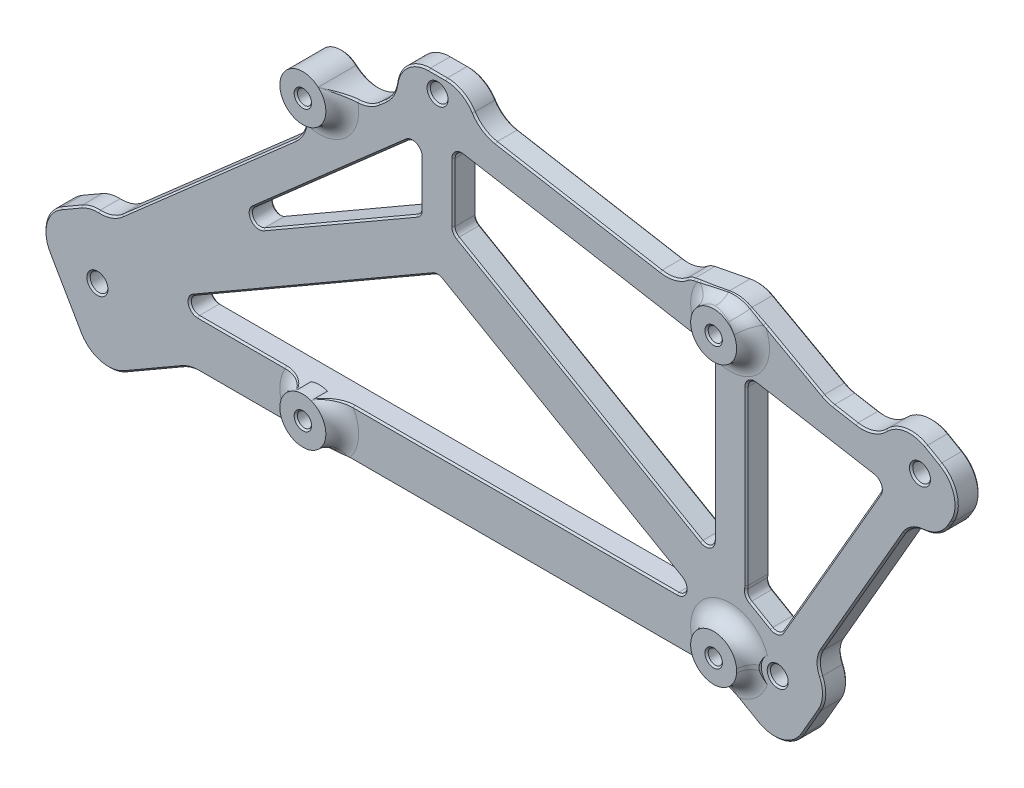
SolidWorks part; units mm, degrees
ref_plane "Płaszczyzna przednia" through (0, 0, 0) normal (0, 0, 1) x (1, 0, 0)
ref_plane "Płaszczyzna górna" through (0, 0, 0) normal (0, 1, 0) x (1, 0, 0)
ref_plane "Płaszczyzna prawa" through (0, 0, 0) normal (1, 0, 0) x (0, 0, -1)
sketch "Szkic1" plane through (0, 0, 0) normal (0, 0, 1) x (1, 0, 0)
  line L0 (-170.2972, -52.083) -> (-130.9522, -29.3671)
  line L1 (-130.4522, -29.2331) -> (-63.6654, -29.2331)
  line L2 (-63.1654, -29.3671) -> (-23.8203, -52.083)
  line L3 (92.7156, 157.7631) -> (-49.7844, -89.0541)
  line L4 (-286.8331, 157.7631) -> (-144.3331, -89.0541)
  line L5 (-239.5588, 239.6447) -> (45.4412, 239.6447)
  line L6 (0.4412, 198.213) -> (0.4412, 243.6447)
  line L7 (33.9686, 139.8739) -> (0.5752, 197.713)
  line L8 (73.6797, 116.792) -> (34.3346, 139.5079)
  line L9 (-228.454, 139.5089) -> (-267.7991, 116.7931)
  line L10 (-213.1413, 166.0521) -> (-205.4413, 179.3889)
  line L11 (-194.5588, 243.6447) -> (-194.5588, 198.213)
  line L12 (-112.0588, 114.6447) -> (-112.0588, 209.6447)
  line L13 (-82.0588, 114.6447) -> (-82.0588, 209.6447)
  line L14 (-79.2876, 109.8449) -> (2.9848, 62.3449)
  line L15 (-94.2876, 83.8641) -> (-12.0152, 36.3641)
  line L16 (-182.1024, 36.3641) -> (-99.8299, 83.8641)
  line L17 (-114.8299, 109.8449) -> (-197.1024, 62.3449)
  line L18 (-127.7266, 15.9423) -> (-127.7266, -9.6077)
  line L19 (-127.7266, -9.6077) -> (-161.4266, -9.6077)
  line L20 (-161.4266, -9.6077) -> (-161.4266, 15.9423)
  line L21 (-161.4266, 15.9423) -> (-127.7266, 15.9423)
  line L22 (-88.1564, 15.9423) -> (-88.1564, -9.6077)
  line L23 (-88.1564, -9.6077) -> (-121.8564, -9.6077)
  line L24 (-121.8564, -9.6077) -> (-121.8564, 15.9423)
  line L25 (-121.8564, 15.9423) -> (-88.1564, 15.9423)
  line L26 (-21.873, -10.118) -> (-80.873, -10.118)
  line L27 (-83.873, -7.118) -> (-83.873, 16.882)
  line L28 (-80.873, 19.882) -> (-21.873, 19.882)
  line L29 (-18.873, 16.882) -> (-18.873, -7.118)
  line L30 (-78.2007, 139.4434) -> (-78.2007, 185.4434)
  line L31 (-78.2007, 185.4434) -> (5.7993, 185.4434)
  line L32 (5.7993, 185.4434) -> (5.7993, 139.4434)
  line L33 (5.7993, 139.4434) -> (-78.2007, 139.4434)
  line L34 (-83.1934, 227.2419) -> (-83.1934, 156.9419)
  line L35 (-83.1934, 156.9419) -> (-183.8934, 156.9419)
  line L36 (-183.8934, 156.9419) -> (-183.8934, 227.2419)
  line L37 (-183.8934, 227.2419) -> (-83.1934, 227.2419)
  line L38 (-194.5588, 23.3553) -> (-194.5588, 133.3553)
  line L39 (-194.5588, 133.3553) -> (0.4412, 133.3553)
  line L40 (0.4412, 133.3553) -> (0.4412, 23.3553)
  line L41 (0.4412, 23.3553) -> (-194.5588, 23.3553)
  line L42 (-239.5588, 209.6447) -> (45.4412, 209.6447)
  line L43 (-260.8524, 172.7631) -> (-118.3524, -74.0541)
  line L44 (66.7348, 172.7631) -> (-75.7652, -74.0541)
  line L45 (-86.6216, 146.6919) -> (-107.8381, 146.6919)
  line L46 (23.9013, 133.3553) -> (4.8104, 133.3553)
  line L47 (23.9013, 93.3553) -> (23.9013, 133.3553)
  line L48 (4.8104, 93.3553) -> (23.9013, 93.3553)
  line L49 (4.8104, 133.3553) -> (4.8104, 93.3553)
  circle A0 centre (-133.0588, 38.3553) radius 1.65
  circle A1 centre (-133.0588, 123.3553) radius 1.65
  circle A2 centre (-8.0588, 38.3553) radius 1.65
  circle A3 centre (-8.0588, 123.3553) radius 1.65
  circle A4 centre (-2.5588, 128.3553) radius 2
  circle A5 centre (-189.5588, 28.3553) radius 2
  circle A6 centre (-130.0766, 3.1673) radius 1.65
  circle A7 centre (-159.0766, 3.1673) radius 1.65
  circle A8 centre (-119.5064, 3.1673) radius 1.65
  circle A9 centre (-90.5064, 3.1673) radius 1.65
  circle A10 centre (-80.373, 16.382) radius 1.25
  circle A11 centre (-80.373, -6.618) radius 1.25
  circle A12 centre (-22.373, 16.382) radius 1.25
  circle A13 centre (-22.373, -6.618) radius 1.25
  circle A14 centre (-74.2007, 143.4434) radius 1.6
  circle A15 centre (1.7993, 143.4434) radius 1.6
  circle A16 centre (1.7993, 181.4434) radius 1.6
  circle A17 centre (-74.2007, 181.4434) radius 1.6
  circle A18 centre (-85.9434, 159.6919) radius 1.75
  circle A19 centre (-149.4434, 186.3919) radius 1.75
  circle A20 centre (-101.4434, 223.9919) radius 1.75
  circle A21 centre (-163.3434, 223.9919) radius 1.75
  circle A22 centre (-181.1434, 188.9919) radius 1.75
  arc A23 (-83.873, -7.118) -> (-80.873, -10.118) centre (-80.873, -7.118) ccw
  arc A24 (-80.873, 19.882) -> (-83.873, 16.882) centre (-80.873, 16.882) ccw
  arc A25 (-18.873, 16.882) -> (-21.873, 19.882) centre (-21.873, 16.882) ccw
  arc A26 (-21.873, -10.118) -> (-18.873, -7.118) centre (-21.873, -7.118) ccw
  circle A27 centre (10.3104, 130.8553) radius 1.5
  circle A28 centre (21.4013, 98.8553) radius 1.5
  circle A29 centre (-97.0588, 151.4419) radius 2.7
  dimension "D1" = 30
sketch "Szkic2" plane through (0, 0, 0) normal (0, 0, 1) x (1, 0, 0)
  line L0 (6.4412, 38.3316) -> (49.7252, 113.3016) construction
  line L1 (92.7156, 157.7631) -> (-49.7844, -89.0541) construction
  line L2 (-286.8331, 157.7631) -> (-144.3331, -89.0541) construction
  line L3 (-112.0588, 114.6447) -> (-112.0588, 209.6447) construction
  line L4 (-194.5588, 23.3553) -> (-194.5588, 133.3553) construction
  line L5 (-97.2298, 146.6919) -> (-97.2298, 133.3553) construction
  line L6 (-86.6216, 146.6919) -> (-107.8381, 146.6919) construction
  line L7 (-194.5588, 133.3553) -> (0.4412, 133.3553) construction
  line L8 (0.4412, 133.3553) -> (0.4412, 23.3553) construction
  line L9 (73.6797, 116.792) -> (34.3346, 139.5079) construction
  line L10 (-109.7298, 145.1919) -> (-84.7298, 145.1919)
  line L11 (-84.7298, 145.1919) -> (-84.7298, 133.1919)
  line L12 (-109.7298, 145.1919) -> (-109.7298, 133.1919)
  line L13 (-200.8841, 13.895) -> (-220.3841, 47.67)
  line L14 (64.5505, 113.9798) -> (9.053, 17.8553)
  line L15 (9.053, 17.8553) -> (-12.5976, 30.3553)
  line L16 (-200.8841, 13.895) -> (-172.374, 30.3553)
  line L17 (-220.3841, 47.67) -> (-198.7334, 60.17)
  line L18 (-198.7334, 60.17) -> (-194.2674, 52.4346)
  line L19 (-194.2674, 52.4346) -> (-102.2298, 105.5726)
  line L20 (-102.2298, 105.5726) -> (-102.2298, 133.1919)
  line L21 (-102.2298, 133.1919) -> (-109.7298, 133.1919)
  line L22 (-84.7298, 133.1919) -> (-92.2298, 133.1919)
  line L23 (-92.2298, 133.1919) -> (-92.2298, 105.7701)
  line L24 (64.5505, 113.9798) -> (42.8999, 126.4798)
  line L26 (-114.8299, 109.8449) -> (-197.1024, 62.3449) construction
  line L27 (-172.374, 30.3553) -> (-12.5976, 30.3553)
  line L28 (42.8999, 126.4798) -> (35.3999, 113.4894)
  line L29 (35.3999, 113.4894) -> (41.8951, 109.7394)
  line L30 (41.8951, 109.7394) -> (9.6111, 53.822)
  line L31 (9.6111, 53.822) -> (3.1159, 57.572)
  line L32 (3.1159, 57.572) -> (0.1499, 52.4346)
  line L33 (0.1499, 52.4346) -> (-92.2298, 105.7701)
  line L34 (-79.2876, 109.8449) -> (2.9848, 62.3449) construction
  line L36 (66.7348, 172.7631) -> (-75.7652, -74.0541) construction
  circle A0 centre (-97.0588, 140.0236) radius 2.7
  circle A1 centre (6.4412, 38.3316) radius 2.7
  circle A2 centre (-200.5588, 38.3316) radius 2.7
  circle A3 centre (49.7252, 113.3016) radius 2.7
  circle A4 centre (-200.5588, 38.3316) radius 6 construction
  circle A5 centre (-97.0588, 140.0236) radius 6 construction
  circle A6 centre (49.7252, 113.3016) radius 6 construction
  circle A7 centre (6.4412, 38.3316) radius 6 construction
  point P27 (-97.2298, 140.0236)
  dimension "D4" = 5.4
  dimension "D5" = 12
  dimension "D1" = 15
  dimension "D2" = 15
  dimension "D3" = 15
  dimension "D6" = 15
  dimension "D7" = 12.5
  dimension "D8" = 12.5
  dimension "D9" = 1.5
  dimension "D10" = 12.5
  dimension "D11" = 12.5
  dimension "D12" = 10
  dimension "D13" = 12
  dimension "D14" = 10
  dimension "D15" = 25
  dimension "D16" = 18
  dimension "D17" = 21
  dimension "D18" = 8
  dimension "D19" = 25
  dimension "D20" = 8
  dimension "D21" = 10
  dimension "D22" = 25
  dimension "D23" = 10
  dimension "D24" = 25
  dimension "D25" = 15
  dimension "D26" = 15
extrude "Dodanie-wyciągnięcie1" add sketch "Szkic2" along normal blind 7
sketch "Szkic3" plane through (0, 0, 7) normal (0, 0, 1) x (1, 0, 0)
  line L0 (-92.2298, 133.1919) -> (41.8951, 109.7394) construction
  line L1 (-91.3686, 138.1172) -> (42.7563, 114.6647)
  line L2 (-93.091, 128.2666) -> (41.0339, 104.8142)
  line L3 (-102.2298, 133.1919) -> (-194.2674, 52.4346) construction
  line L4 (-98.9321, 129.4336) -> (-190.9697, 48.6763)
  line L5 (-105.5275, 136.9503) -> (-197.5651, 56.193)
  arc A0 (-91.3686, 138.1172) -> (-93.091, 128.2666) centre (-92.2298, 133.1919) ccw
  arc A1 (41.0339, 104.8142) -> (42.7563, 114.6647) centre (41.8951, 109.7394) ccw
  arc A2 (-98.9321, 129.4336) -> (-105.5275, 136.9503) centre (-102.2298, 133.1919) ccw
  arc A3 (-197.5651, 56.193) -> (-190.9697, 48.6763) centre (-194.2674, 52.4346) ccw
  point P4 (-25.1674, 121.4657)
  point P13 (-148.2486, 92.8133)
  dimension "D1" = 10
  dimension "D2" = 10
extrude "Dodanie-wyciągnięcie2" add sketch "Szkic3" against normal up to surface (7 mm away) contours L5 L4 M20 M24 M23 M22 M21 | L2 L1 M16 M12 M11 M10 M18 M17
sketch "Szkic4" plane through (0, 0, 7) normal (0, 0, 1) x (1, 0, 0)
  line L0 (10.3104, 130.8553) -> (-18.1826, 125.3202) construction
  line L2 (11.2639, 125.9471) -> (-17.2291, 120.412)
  line L3 (9.3569, 135.7636) -> (-19.1361, 130.2284)
  line L4 (32.0587, 92.7023) -> (-1.9324, 112.3271) construction
  line L5 (39.2333, 105.129) -> (9.6111, 53.822) construction
  line L7 (29.5587, 88.3722) -> (-4.4324, 107.9969)
  line L8 (34.5587, 97.0324) -> (0.5676, 116.6572)
  line L9 (-133.0588, 123.3553) -> (-127.8226, 117.3877) construction
  line L11 (-127.7971, 127.9721) -> (-122.5609, 122.0045)
  line L12 (-138.3204, 118.7385) -> (-133.0843, 112.7709)
  line L14 (-109.7298, 133.263) -> (-196.8165, 56.8498) construction
  line L15 (-92.2298, 128.1161) -> (39.2333, 105.129) construction
  line L16 (-84.7298, 136.9564) -> (36.6908, 115.7253) construction
  arc A0 (11.2639, 125.9471) -> (9.3569, 135.7636) centre (10.3104, 130.8553) ccw
  arc A1 (-19.1361, 130.2284) -> (-17.2291, 120.412) centre (-18.1826, 125.3202) ccw
  arc A2 (29.5587, 88.3722) -> (34.5587, 97.0324) centre (32.0587, 92.7023) ccw
  arc A3 (0.5676, 116.6572) -> (-4.4324, 107.9969) centre (-1.9324, 112.3271) ccw
  arc A5 (-127.7971, 127.9721) -> (-138.3204, 118.7385) centre (-133.0588, 123.3553) ccw
  arc A6 (-133.0843, 112.7709) -> (-122.5609, 122.0045) centre (-127.8226, 117.3877) ccw
  point P5 (-3.9361, 128.0878)
  point P17 (15.0631, 102.5147)
  point P22 (-130.4407, 120.3715)
  dimension "D3" = 14
  dimension "D1" = 10
  dimension "D2" = 10
extrude "Dodanie-wyciągnięcie3" add sketch "Szkic4" against normal up to surface (7 mm away)
sketch "Szkic5" plane through (0, 0, 7) normal (0, 0, 1) x (1, 0, 0)
  line L0 (-97.0588, 92.3923) -> (-179.3312, 44.8923)
  line L1 (-179.3312, 44.8923) -> (-14.7864, 44.8923)
  line L2 (-14.7864, 44.8923) -> (-97.0588, 92.3923)
  line L3 (-182.1024, 36.3641) -> (-99.8299, 83.8641) construction
  line L4 (-94.2876, 83.8641) -> (-12.0152, 36.3641) construction
  dimension "D1" = 6
  dimension "D2" = 6
extrude "Wytnij-wyciągnięcie1" cut sketch "Szkic5" against normal through all
fillet "Zaokrąglenie1" radius 10 12 edges at (-6.8577, 113.1883, 3.5) (-4.3835, 122.9074, 3.5) (-23.1078, 126.1814, 3.5) (-84.7298, 145.1919, 3.5) (-109.7298, 145.1919, 3.5) (42.8999, 126.4798, 3.5) (64.5505, 113.9798, 3.5) (9.053, 17.8553, 3.5) (-12.5976, 30.3553, 3.5) (-172.374, 30.3553, 3.5) (-220.3841, 47.67, 3.5) (-200.8841, 13.895, 3.5)
fillet "Zaokrąglenie2" radius 10 6 edges at (36.6908, 115.7253, 3.5) (-84.7298, 136.9564, 3.5) (-122.5609, 122.0045, 3.5) (-133.0843, 112.7709, 3.5) (-198.7334, 60.17, 3.5) (-109.7298, 133.263, 3.5)
fillet "Zaokrąglenie7" radius 10 1 edges at (-196.8165, 56.8498, 3.5)
sketch "Szkic6" plane through (0, 0, 7) normal (0, 0, 1) x (1, 0, 0)
  line L0 (0.1499, 52.4346) -> (3.1159, 57.572)
  line L1 (3.1159, 57.572) -> (9.6111, 53.822)
  line L2 (9.6111, 53.822) -> (6.6451, 48.6846)
  line L3 (6.6451, 48.6846) -> (0.1499, 52.4346)
extrude "Wytnij-wyciągnięcie2" cut sketch "Szkic6" against normal through all
fillet "Zaokrąglenie3" radius 2.5 13 edges at (39.2333, 105.129, 3.5) (-92.2298, 128.1161, 3.5) (12.4119, 109.8189, 3.5) (29.5587, 88.3722, 3.5) (34.5587, 97.0324, 3.5) (-97.0588, 92.3923, 3.5) (-14.7864, 44.8923, 3.5) (-179.3312, 44.8923, 3.5) (6.6451, 48.6846, 3.5) (-102.2298, 105.5726, 3.5) (-92.2298, 105.7701, 3.5) (-172.101, 65.2325, 3.5) (-102.2298, 126.54, 3.5)
sketch "Szkic7" plane through (0, 0, 7) normal (0, 0, 1) x (1, 0, 0)
  circle A0 centre (-8.0588, 123.3553) radius 7
  circle A1 centre (-133.0588, 123.3553) radius 7
  circle A3 centre (-133.0588, 38.3553) radius 7
  circle A4 centre (-8.0588, 38.3553) radius 7
extrude "Dodanie-wyciągnięcie4" add sketch "Szkic7" along normal blind 5
hole_wizard "Otwór pod śrubę M41" positions "Szkic8" profile "Szkic9" hole size "M4" standard "DIN"
sketch "Szkic8" plane through (0, 0, 12) normal (0, 0, 1) x (1, 0, 0)
  point P0 (-133.0588, 123.3553)
  point P3 (-133.0588, 38.3553)
  point P6 (-8.0588, 38.3553)
  point P9 (-8.0588, 123.3553)
sketch "Szkic9" plane through (-133.0588, 123.3553, 12) normal (1, 0, 0) x (0, -1, 0)
  line L0 (0, 0) -> (0, 12)
  line L1 (0, 12) -> (2.15, 12)
  line L2 (2.15, 12) -> (2.15, 0)
  line L5 (2.15, 0) -> (0, 0)
  line L11 (0, -6.35) -> (0, 107.95) construction
  dimension "Średnica otworu na wylot" = 4.3
  dimension "Głębokość otworu na wylot" = 12
hole_wizard "Otwór Ø7.8 (7.8)1" positions "Szkic14" profile "Szkic15" hole size "Ø7.8" standard "DIN"
sketch "Szkic14" plane through (0, 0, 0) normal (0, 0, -1) x (-1, 0, 0)
  point P0 (8.0588, 123.3553)
  point P3 (133.0588, 123.3553)
  point P6 (133.0588, 38.3553)
  point P9 (8.0588, 38.3553)
sketch "Szkic15" plane through (-8.0588, 123.3553, 0) normal (1, 0, 0) x (0, 1, 0)
  line L0 (0, 0) -> (0, 6.3434)
  line L1 (0, 6.3434) -> (3.9, 4)
  line L2 (3.9, 4) -> (3.9, 0)
  line L5 (3.9, 0) -> (0, 0)
  line L10 (0, 6.3434) -> (-3.9, 4) construction
  line L11 (0, -6.35) -> (0, 107.95) construction
  dimension "Średnica otworu" = 7.8
  dimension "Głębokość otworu" = 4
  dimension "Kąt wiertła" = 118
sketch "Szkic16" plane through (0, 0, 7) normal (0, 0, 1) x (1, 0, 0)
  line L0 (51.4085, 91.2172) -> (26.4085, 47.916) construction
  line L1 (57.9037, 87.4672) -> (32.9037, 44.166)
  line L2 (44.9133, 94.9672) -> (19.9133, 51.666)
  line L3 (14.053, 26.5156) -> (59.5505, 105.3196) construction
  line L4 (49.7252, 113.3016) -> (6.4412, 38.3316) construction
  line L5 (28.0832, 75.8166) -> (38.9085, 69.5666) construction
  arc A0 (57.9037, 87.4672) -> (44.9133, 94.9672) centre (51.4085, 91.2172) ccw
  arc A1 (19.9133, 51.666) -> (32.9037, 44.166) centre (26.4085, 47.916) ccw
  point P2 (38.9085, 69.5666)
  dimension "D1" = 50
  dimension "D2" = 5
extrude "Wytnij-wyciągnięcie4" cut sketch "Szkic16" against normal through all
sketch "Szkic20" plane through (0, 0, 7) normal (0, 0, 1) x (1, 0, 0)
  line L0 (-4.8896, 132.996) -> (20.1898, 119.1616)
  line L2 (9.3569, 135.7636) -> (-19.1361, 130.2284) construction
  line L3 (-4.8896, 132.996) -> (2.848, 147.0228)
  line L4 (2.848, 147.0228) -> (27.9274, 133.1884)
  line L5 (27.9274, 133.1884) -> (20.1898, 119.1616)
  line L6 (-12.9456, 114.2528) -> (39.2333, 105.129)
  line L7 (39.2333, 105.129) -> (28.3087, 86.2071)
  line L8 (28.3087, 86.2071) -> (-12.9456, 106.5722)
  line L9 (-12.9456, 106.5722) -> (-12.9456, 114.2528)
  line L10 (-89.2992, 127.6036) -> (-12.9456, 114.2528) construction
  line L11 (28.3087, 86.2071) -> (7.8951, 50.8497) construction
  arc A1 (15.2136, 129.8761) -> (23.2975, 118.0672) centre (25.0199, 127.9177) ccw construction
extrude "Wytnij-wyciągnięcie5" cut sketch "Szkic20" against normal through all
sketch "Szkic21" plane through (0, 0, 7) normal (0, 0, 1) x (1, 0, 0)
  line L0 (-8.0588, 113.3983) -> (-8.0588, 57.1739) construction
  line L1 (-89.2992, 127.6036) -> (39.2333, 105.129) construction
  line L2 (4.48, 49.9346) -> (-90.9798, 105.0484) construction
  line L3 (-3.0588, 113.3983) -> (-3.0588, 57.1739)
  line L4 (-13.0588, 113.3983) -> (-13.0588, 57.1739)
  line L5 (-8.0588, 123.3553) -> (-8.0588, 38.3553) construction
  arc A0 (-3.0588, 113.3983) -> (-13.0588, 113.3983) centre (-8.0588, 113.3983) ccw
  arc A1 (-13.0588, 57.1739) -> (-3.0588, 57.1739) centre (-8.0588, 57.1739) ccw
  point P6 (-8.0588, 85.2861)
  dimension "D1" = 10
extrude "Dodanie-wyciągnięcie5" add sketch "Szkic21" against normal up to surface (7 mm away)
fillet "Zaokrąglenie8" radius 10 3 edges at (-4.8896, 132.996, 3.5) (55.1585, 97.7124, 3.5) (22.6585, 41.4208, 3.5)
fillet "Zaokrąglenie9" radius 2.5 5 edges at (-13.0588, 60.0607, 3.5) (-3.7286, 54.6739, 3.5) (39.2333, 105.129, 3.5) (-3.0588, 112.524, 3.5) (-12.984, 114.2595, 3.5)
fillet "Zaokrąglenie10" radius 5 4 edges at (-128.442, 118.0937, 7) (-15.0588, 123.3553, 7) (-15.0588, 38.3553, 7) (-133.0588, 31.3553, 7)
sketch "Szkic22" plane through (0, 0, 7) normal (0, 0, 1) x (1, 0, 0)
  circle A0 centre (6.4412, 38.3316) radius 5
  dimension "D1" = 10
extrude "Wytnij-wyciągnięcie6" cut sketch "Szkic22" along normal through all
chamfer "Sfazowanie1" distance 0.5 angle 45 78 edges at (52.4252, 113.3016, 0) (9.1412, 38.3316, 0) (-94.3588, 140.0236, 0) (-197.8588, 38.3316, 0) (-102.5648, 105.766, 0) (-126.8139, 91.3789, 0) (-153.43, 78.6156, 0) (-129.7128, 102.4254, 0) (-103.6983, 123.2978, 0) (-102.2298, 114.0182, 0) (-172.4159, 46.7452, 0) (-134.7799, 70.614, 0) (-97.0588, 92.0055, 0) (-59.3376, 70.614, 0) (-21.7017, 46.7452, 0) (-97.0588, 44.8923, 0) (-11.9588, 38.3553, 0) (-136.9588, 38.3553, 0) (-136.9588, 123.3553, 0) (-11.9588, 123.3553, 0) (60.5495, 112.9078, 0) (53.7252, 120.2298, 0) (45.1549, 122.7203, 0) (35.2455, 117.1694, 0) (26.8553, 117.4451, 0) (21.6983, 118.4855, 0) (9.2382, 125.2028, 0) (-4.9887, 132.3662, 0) (-13.7932, 131.2664, 0) (-20.2666, 129.8652, 0) (-25.0243, 127.401, 0) (-54.2909, 131.6339, 0) (-83.2295, 137.5646, 0) (-89.7461, 143.9499, 0) (-97.1514, 145.1919, 0) (-106.2931, 142.7367, 0) (-110.7363, 133.2133, 0) (-114.0401, 129.481, 0) (-121.7781, 126.034, 0) (-137.6756, 128.617, 0) (-137.1813, 112.5187, 0) (-166.8428, 83.1499, 0) (-196.4331, 58.1331, 0) (-202.9514, 57.2812, 0) (-208.6376, 54.4519, 0) (-216.3831, 46.598, 0) (-210.6341, 30.7825, 0) (-199.812, 17.896, 0) (-183.4592, 23.9553, 0) (-172.2827, 30.0146, 0) (-92.4858, 30.3553, 0) (-12.6889, 30.0146, 0) (-4.9422, 25.9355, 0) (7.981, 21.8563, 0) (16.6404, 30.9971, 0) (20.5586, 40.0555, 0) (18.9153, 48.2333, 0) (32.4133, 73.3166, 0) (47.3871, 97.5479, 0) (55.2909, 100.2136, 0) (59.0699, 104.4871, 0) (37.5453, 104.3404, 0) (22.6702, 76.441, 0) (6.3771, 49.6849, 0) (1.2725, 51.7865, 0) (-2.9557, 54.7574, 0) (-3.0799, 56.7152, 0) (-3.0588, 83.3614, 0) (-2.1671, 111.4629, 0) (17.7914, 108.8782, 0) (-91.8949, 105.9635, 0) (-92.2298, 116.1772, 0) (-91.3382, 127.0549, 0) (-52.2137, 121.119, 0) (-13.6448, 113.7801, 0) (-13.0588, 88.2813, 0) (-14.3088, 62.2257, 0) (-53.8943, 83.6371, 0)
chamfer "Sfazowanie2" distance 0.5 angle 45 90 edges at (-130.9088, 123.3553, 12) (-5.9088, 123.3553, 12) (-5.9088, 38.3553, 12) (-130.9088, 38.3553, 12) (9.1412, 38.3316, 7) (52.4252, 113.3016, 7) (-94.3588, 140.0236, 7) (-197.8588, 38.3316, 7) (-102.5648, 105.766, 7) (-102.2298, 114.0182, 7) (-126.8139, 91.3789, 7) (-103.6983, 123.2978, 7) (-153.43, 78.6156, 7) (-129.7128, 102.4254, 7) (6.3771, 49.6849, 7) (22.6702, 76.441, 7) (1.2725, 51.7865, 7) (37.5453, 104.3404, 7) (-2.9557, 54.7574, 7) (17.7914, 108.8782, 7) (-3.0799, 56.7152, 7) (-2.1671, 111.4629, 7) (-3.0588, 83.3614, 7) (-15.8433, 114.7595, 7) (-13.7388, 113.8857, 7) (-52.9288, 121.2441, 7) (-13.0628, 112.3131, 7) (-91.3382, 127.0549, 7) (-13.0588, 88.2813, 7) (-92.2298, 116.1772, 7) (-14.3088, 62.2257, 7) (-91.8949, 105.9635, 7) (-53.8943, 83.6371, 7) (-124.9711, 126.5724, 8.2402) (-118.0372, 126.7423, 7) (-114.0401, 129.481, 7) (-110.7363, 133.2133, 7) (-106.2931, 142.7367, 7) (-97.1514, 145.1919, 7) (-89.7461, 143.9499, 7) (-83.2295, 137.5646, 7) (-54.2909, 131.6339, 7) (-25.0243, 127.401, 7) (-20.2666, 129.8652, 7) (-18.4148, 130.3686, 7) (-13.072, 131.4065, 7) (-4.9887, 132.3662, 7) (0.4446, 130.0535, 7) (11.3962, 124.0124, 7) (21.6983, 118.4855, 7) (26.8553, 117.4451, 7) (35.2455, 117.1694, 7) (45.1549, 122.7203, 7) (53.7252, 120.2298, 7) (-137.3, 115.7546, 8.2402) (60.5495, 112.9078, 7) (-138.3699, 108.9016, 7) (59.0699, 104.4871, 7) (-166.8428, 83.1499, 7) (55.2909, 100.2136, 7) (-196.4331, 58.1331, 7) (47.3871, 97.5479, 7) (-202.9514, 57.2812, 7) (32.4133, 73.3166, 7) (-208.6376, 54.4519, 7) (18.9153, 48.2333, 7) (-216.3831, 46.598, 7) (20.5586, 40.0555, 7) (-210.6341, 30.7825, 7) (16.6404, 30.9971, 7) (-199.812, 17.896, 7) (7.981, 21.8563, 7) (-183.4592, 23.9553, 7) (-2.795, 24.6958, 7) (-172.2827, 30.0146, 7) (-8.1299, 27.7759, 7) (-155.8488, 30.3553, 7) (-12.6889, 30.0146, 7) (-133.0588, 30.3553, 7) (-16.1401, 30.3553, 7) (-70.5588, 30.3553, 7) (-136.5915, 44.8923, 9.9703) (-129.8284, 44.8923, 10.3176) (-156.5615, 44.8923, 7) (-172.4159, 46.7452, 7) (-73.556, 44.8923, 7) (-134.7799, 70.614, 7) (-21.7017, 46.7452, 7) (-97.0588, 92.0055, 7) (-59.3376, 70.614, 7)
